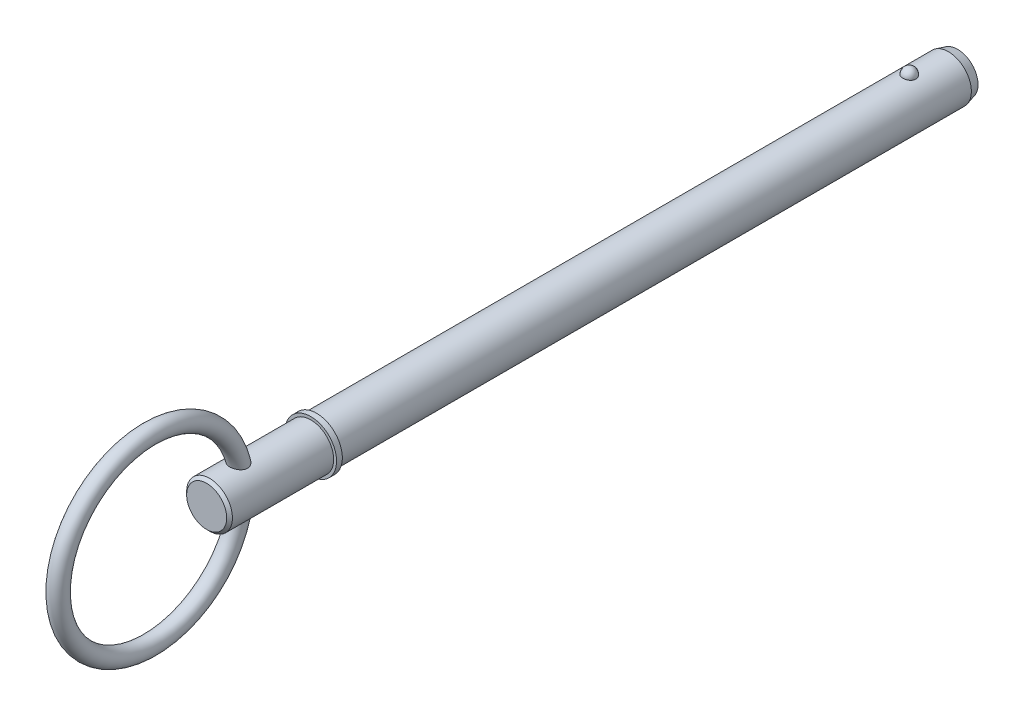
SolidWorks part; units mm, degrees
ref_plane "Front Plane" through (0, 0, 0) normal (0, 0, 1) x (1, 0, 0)
ref_plane "Top Plane" through (0, 0, 0) normal (0, 1, 0) x (1, 0, 0)
ref_plane "Right Plane" through (0, 0, 0) normal (1, 0, 0) x (0, 0, -1)
sketch "Sketch2" plane through (0, 0, 0) normal (0, 0, 1) x (1, 0, 0)
  circle A0 centre (0, 0) radius 3.97
  point P3 (0, 3.97)
  dimension "D1" = 7.94
extrude "Boss-Extrude1" add sketch "Sketch2" along normal blind 101.6
sketch "Sketch3" plane through (0, 0, 0) normal (0, 0, -1) x (-1, 0, 0)
  circle A0 centre (0, 0) radius 3.97
  dimension "D1" = 7.94
extrude "Boss-Extrude2" add sketch "Sketch3" along normal blind 9.53
chamfer "Chamfer1" distance 1.586 angle 15 1 edges at (-3.97, 0, -9.53)
sketch "Sketch18" plane through (0, 0, 0) normal (1, 0, 0) x (0, 0, -1)
  line L0 (7.944, 3.97) -> (-101.6, 3.97) construction
  line L1 (1.15, 5.12) -> (1.15, 2.82)
  line L2 (-101.6, -3.97) -> (7.944, -3.97) construction
  arc A0 (1.15, 5.12) -> (1.15, 2.82) centre (1.15, 3.97) ccw
  point P4 (0, 3.97)
  dimension "D1" = 9.09
revolve "Revolve1" add sketch "Sketch18" angle 360 about L1
sketch "Sketch19" plane through (0, 0, 0) normal (1, 0, 0) x (0, 0, -1)
  line L0 (-33.7288, 0) -> (-46.4542, 0) construction
sketch "Sketch20" plane through (0, 0, 0) normal (1, 0, 0) x (0, 0, -1)
  line L0 (-101.6, 0) -> (-101.6, 4.47)
  line L1 (-101.6, 3.97) -> (-101.6, -3.97) construction
  line L2 (-101.6, 4.47) -> (-102.6, 4.47)
  line L3 (-102.6, 4.47) -> (-102.6, 0)
  line L4 (-33.7288, 0) -> (-46.4542, 0) construction
  line L5 (-102.6, 0) -> (-101.6, 0)
  dimension "D1" = 4.47
  dimension "D2" = 1
revolve "Revolve2" add sketch "Sketch20" angle 360 about L0
sketch "Sketch21" plane through (0, 0, 101.6) normal (0, 0, -1) x (-1, 0, 0)
  circle A0 centre (0, 0) radius 3.97
  dimension "D1" = 7.94
extrude "Boss-Extrude3" add sketch "Sketch21" against normal blind 19.05
chamfer "Chamfer2" distance 0.5 angle 45 1 edges at (-3.97, 0, 120.65)
sketch "Sketch23" plane through (0, 0, 0) normal (1, 0, 0) x (0, 0, -1)
  line L0 (-120.65, 3.47) -> (-120.65, -3.47) construction
  circle A0 centre (-130.525, 0) radius 15.875
  point P2 (-114.65, 0)
  dimension "D1" = 31.75
  dimension "D2" = 6
sketch "Sketch24" plane through (0, 0, 0) normal (0, 1, 0) x (1, 0, 0)
  circle A0 centre (0, -114.65) radius 1.5
  dimension "D1" = 3
sweep "Sweep1" add profiles "Sketch24" path "Sketch23"
